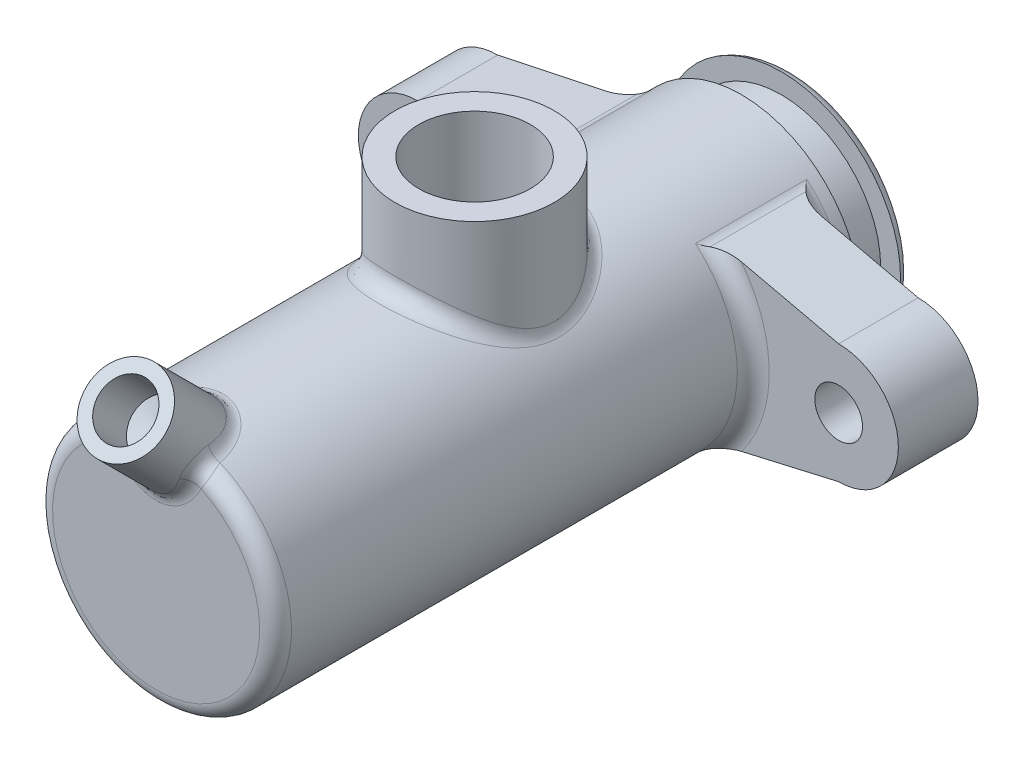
SolidWorks part; units mm, degrees
ref_plane "Plan de face" through (0, 0, 0) normal (0, 0, 1) x (1, 0, 0)
ref_plane "Plan de dessus" through (0, 0, 0) normal (0, 1, 0) x (1, 0, 0)
ref_plane "Plan de droite" through (0, 0, 0) normal (1, 0, 0) x (0, 0, -1)
sketch "Esquisse1" plane through (0, 0, 0) normal (0, 0, 1) x (1, 0, 0)
  circle A0 centre (0, 0) radius 15
  dimension "D1" = 30
extrude "Extrusion1" add sketch "Esquisse1" along normal blind 80
ref_plane "Plan1" through (0, 0, 10) normal (0, 0, -1) x (-1, 0, 0)
sketch "Esquisse2" plane through (0, 0, 10) normal (0, 0, -1) x (-1, 0, 0)
  line L0 (-25.7235, 7.5) -> (-10.0901, 11.0991)
  line L1 (10.0901, 11.0991) -> (27.094, 7.5)
  line L2 (-25.7235, -7.5) -> (-10.0901, -11.0991)
  line L3 (27.094, -7.5) -> (10.0901, -11.0991)
  arc A0 (-25.7235, 7.5) -> (-25.7235, -7.5) centre (-25.7235, 0) ccw
  arc A1 (27.094, -7.5) -> (27.094, 7.5) centre (27.094, 0) ccw
  circle A2 centre (0, 0) radius 15 construction
  arc A3 (10.0901, 11.0991) -> (-10.0901, 11.0991) centre (0, 0) ccw
  arc A4 (-10.0901, -11.0991) -> (10.0901, -11.0991) centre (0, 0) ccw
  circle A5 centre (-25.7235, 0) radius 3
  circle A6 centre (27.094, 0) radius 3
  dimension "D1" = 15
  dimension "D2" = 15
  dimension "D3" = 6
  dimension "D4" = 6
extrude "Extrusion2" add sketch "Esquisse2" against normal blind 10
sketch "Esquisse3" plane through (0, 0, 0) normal (0, 1, 0) x (1, 0, 0)
  line L0 (15, 0) -> (-15, 0) construction
  circle A0 centre (0, -40) radius 10
  dimension "D2" = 20
  dimension "D3" = 40
extrude "Extrusion3" add sketch "Esquisse3" along normal blind 25
sketch "Esquisse4" plane through (0, 0, 0) normal (1, 0, 0) x (0, 0, -1)
  line L0 (-83.8034, 19.3034) -> (-74.5, 10)
  line L1 (-74.5, 10) -> (-70.9645, 13.5355)
  line L2 (-70.9645, 13.5355) -> (-80.2679, 22.8389)
  line L3 (-80.2679, 22.8389) -> (-83.8034, 19.3034)
  line L4 (-50, 15) -> (-80, 15) construction
  line L5 (-80, 15) -> (-80, -15) construction
  dimension "D1" = 5
  dimension "D2" = 45
  dimension "D3" = 5
  dimension "D4" = 5.5
revolve "Révolution1" add sketch "Esquisse4" angle 360 about L0
sketch "Esquisse5" plane through (0, 0, 0) normal (0, 0, -1) x (-1, 0, 0)
  circle A0 centre (0, 0) radius 10
  dimension "D1" = 20
extrude "Enlèv. mat.-Extru.1" cut sketch "Esquisse5" against normal blind 75
sketch "Esquisse6" plane through (0, 0, 0) normal (1, 0, 0) x (0, 0, -1)
  line L1 (-6.5, 15.7441) -> (-1.5, 15.7441)
  line L2 (-6.5, 15.7441) -> (-6.5, 12.5)
  line L3 (-6.5, 12.5) -> (-1.5, 12.5)
  line L4 (-1.5, 15.7441) -> (-1.5, 12.5)
  line L6 (0, -15) -> (0, 15) construction
  dimension "D1" = 12.5
  dimension "D2" = 5
  dimension "D3" = 1.5
revolve "Enlèvement de matière-Révolution1" cut sketch "Esquisse6" angle 360 about axis through (0, 0, 75) along (0, 0, -1)
hole_wizard "Trou taraudé M81" positions "Esquisse8" profile "Esquisse7" tap size "M8" standard "ISO"
sketch "Esquisse8" plane through (0, 51.5534, 51.5534) normal (0, 0.7071, 0.7071) x (1, 0, 0)
  point P0 (0, -45.6084)
sketch "Esquisse7" plane through (0, 19.3034, 83.8034) normal (1, 0, 0) x (0, -0.7071, 0.7071)
  line L0 (0, 0) -> (0, 8.0429)
  line L1 (0, 8.0429) -> (3.4, 6)
  line L2 (3.4, 6) -> (3.4, 0)
  line L5 (3.4, 0) -> (0, 0)
  line L10 (0, 8.0429) -> (-3.4, 6) construction
  line L11 (0, -6.35) -> (0, 107.95) construction
  dimension "Diamètre du trou pour taraudage" = 6.8
  dimension "Profondeur du trou pour taraudage" = 6
  dimension "Angle de pointe" = 118
sketch "Esquisse9" plane through (0, 51.5534, 51.5534) normal (0, 0.7071, 0.7071) x (1, 0, 0)
  circle A0 centre (0, -45.6084) radius 0.75
  dimension "D1" = 1.5
extrude "Enlèv. mat.-Extru.2" cut sketch "Esquisse9" against normal up to next
hole_wizard "Trou taraudé M161" positions "Esquisse11" profile "Esquisse10" tap size "M16" standard "ISO"
sketch "Esquisse11" plane through (0, 25, 0) normal (0, 1, 0) x (-1, 0, 0)
  circle A0 centre (0, 40) radius 10 construction
  point P0 (0, 40)
sketch "Esquisse10" plane through (0, 25, 40) normal (1, 0, 0) x (0, 0, 1)
  line L0 (0, 0) -> (0, 12)
  line L1 (0, 12) -> (7, 12)
  line L2 (7, 12) -> (7, 0)
  line L5 (7, 0) -> (0, 0)
  line L10 (0, 12) -> (-7, 12) construction
  line L11 (0, -6.35) -> (0, 107.95) construction
  dimension "Diamètre du trou pour taraudage" = 14
  dimension "Profondeur du trou pour taraudage" = 12
  dimension "Angle de pointe" = 180
fillet "Congé1" radius 2 13 edges at (0, 8.4289, 80) (15, 0, 0) (-10.0901, -11.0991, 15) (-15, 0, 10) (-15, 0, 20) (-10.0901, 11.0991, 15) (15, 0, 10) (10.0901, -11.0991, 15) (15, 0, 20) (10.0901, 11.0991, 15) (1.3682, 14.9375, 49.906) (0.0205, 15, 72.429) (0, -15, 80)
sketch "Esquisse12" plane through (0, 13, 0) normal (0, 1, 0) x (1, 0, 0)
  arc A0 (5.0153, -44.8833) -> (2.8659, -42.7905) centre (3.9406, -43.8369) ccw
  arc A1 (-2.8773, -42.7787) -> (-5.0353, -44.8626) centre (-3.9563, -43.8206) ccw
  circle A2 centre (0, -40) radius 7 construction
  arc A3 (4.5423, -34.6739) -> (-4.5639, -34.6924) centre (0, -40) ccw
  arc A4 (2.5956, -36.9565) -> (-2.608, -36.9671) centre (0, -40) ccw
  arc A5 (-4.5639, -34.6924) -> (-2.608, -36.9671) centre (-3.5859, -35.8297) ccw
  arc A6 (2.5956, -36.9565) -> (4.5423, -34.6739) centre (3.569, -35.8152) ccw
  circle A7 centre (0, -40) radius 4 construction
  circle A8 centre (0, -40) radius 7 construction
  arc A9 (-5.0353, -44.8626) -> (5.0153, -44.8833) centre (0, -40) ccw
  arc A10 (-2.8773, -42.7787) -> (2.8659, -42.7905) centre (0, -40) ccw
  dimension "D5" = 3
extrude "Enlèv. mat.-Extru.3" cut sketch "Esquisse12" against normal up to next
